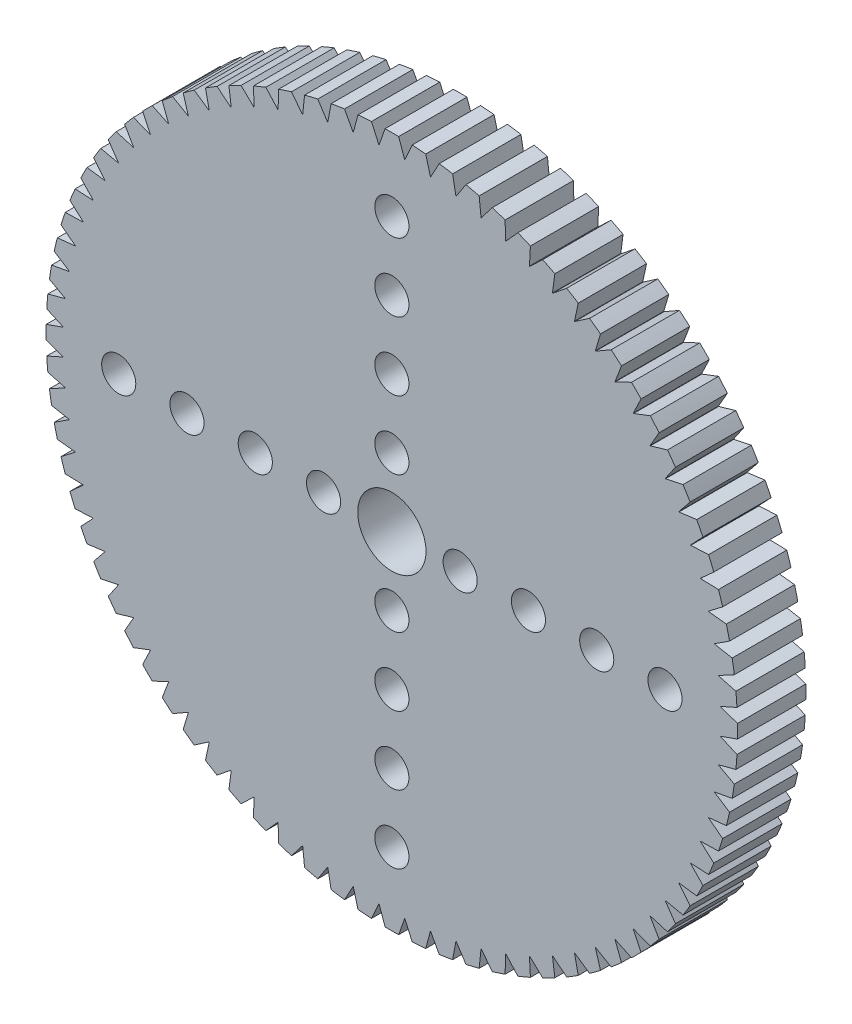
SolidWorks part; units mm, degrees
ref_plane "前视基准面" through (0, 0, 0) normal (0, 0, 1) x (1, 0, 0)
ref_plane "上视基准面" through (0, 0, 0) normal (0, 1, 0) x (1, 0, 0)
ref_plane "右视基准面" through (0, 0, 0) normal (1, 0, 0) x (0, 0, -1)
sketch "草图1" plane through (0, 0, 0) normal (0, 0, 1) x (1, 0, 0)
  line L6 (1.5115, 38.4703) -> (2.3843, 40.4298)
  line L7 (4.5252, 38.2331) -> (3.9697, 40.305)
  arc A3 (2.3843, 40.4298) -> (3.9697, 40.305) centre (0, 0) cw
  arc A4 (4.5252, 38.2331) -> (-4.5252, -38.2331) centre (0, 0) cw
  arc A5 (1.5115, 38.4703) -> (-4.5252, -38.2331) centre (-0.0406, 0.0032) ccw
extrude "凸台-拉伸2" add sketch "草图1" along normal blind 8
pattern_circular "阵列(圆周)1" count 80 over 360 about axis through (0, 0, 0) along (0, 0, 1) of "凸台-拉伸2"
sketch "草图3" plane through (0, 0, 8) normal (0, 0, 1) x (1, 0, 0)
  line L0 (-8, 0) -> (-16, 0) construction
  line L1 (0, 8) -> (0, -8) construction
  circle A0 centre (0, 0) radius 4
  circle A1 centre (8, 0) radius 2
  circle A2 centre (16, 0) radius 2
  circle A3 centre (24, 0) radius 2
  circle A4 centre (32, 0) radius 2
  circle A5 centre (-8, 0) radius 2
  circle A6 centre (-16, 0) radius 2
  circle A7 centre (-24, 0) radius 2
  circle A8 centre (-32, 0) radius 2
  circle A10 centre (0, 8) radius 2
  circle A11 centre (0, 16) radius 2
  circle A12 centre (0, 24) radius 2
  circle A13 centre (0, 32) radius 2
  circle A18 centre (-8, 16) radius 2
  circle A19 centre (-8, 24) radius 2
  circle A20 centre (-8, 32) radius 2
  circle A21 centre (-8, 8) radius 2
  circle A22 centre (0, 0) radius 2
  circle A23 centre (0, -8) radius 2
  circle A24 centre (0, -16) radius 2
  circle A25 centre (0, -24) radius 2
  circle A26 centre (0, -32) radius 2
  dimension "D1" = 8
  dimension "D4" = 8
  dimension "D8" = 16
  dimension "D2" = 4
  dimension "D3" = 2
  dimension "D6" = 2
  dimension "D5" = 5
  dimension "D7" = 2
extrude "切除-拉伸1" cut sketch "草图3" against normal blind 8
